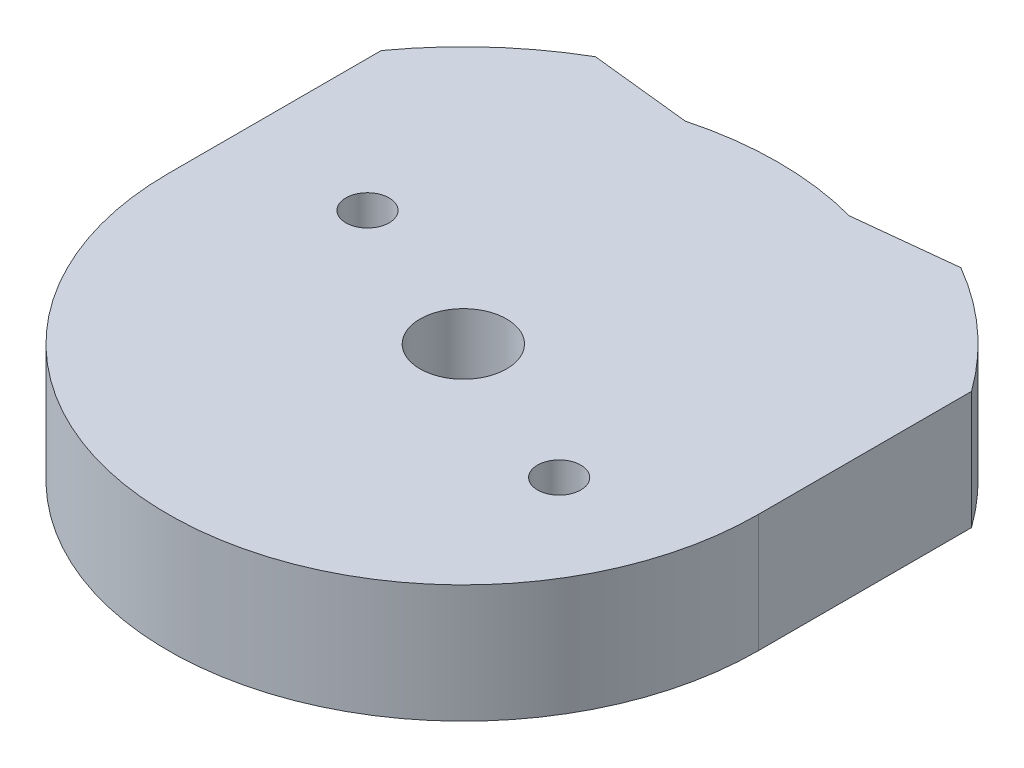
SolidWorks part; units mm, degrees
ref_plane "Face" through (0, 0, 0) normal (0, 0, 1) x (1, 0, 0)
ref_plane "Dessus" through (0, 0, 0) normal (0, 1, 0) x (1, 0, 0)
ref_plane "Droite" through (0, 0, 0) normal (1, 0, 0) x (0, 0, -1)
sketch "Esquisse1" plane through (0, 0, 0) normal (0, 1, 0) x (1, 0, 0)
  line L0 (51.9662, 0) -> (-18.6202, 0) construction
  line L1 (0, -18.98) -> (0, 28.1312) construction
  line L2 (15, -7.2752) -> (15, 19.8861) construction
  line L3 (-15, -14.6253) -> (-15, 19.8861) construction
  line L4 (-20.052, 16) -> (25.0707, 16) construction
  line L5 (-9, -4.0319) -> (-9, 1.7768) construction
  line L6 (15, 0) -> (15, 10.8282)
  line L7 (-15, 0) -> (-15, 10.8282)
  line L8 (-9.2871, 16) -> (-4.1648, 15.4484)
  line L9 (4.1648, 15.4484) -> (9.2871, 16)
  circle A0 centre (0, 0) radius 2.2
  arc A1 (-15, 0) -> (15, 0) centre (0, 0) ccw
  circle A2 centre (0, 0) radius 9 construction
  arc A3 (4.1648, 15.4484) -> (-4.1648, 15.4484) centre (0, 0) ccw
  arc A4 (-9.2871, 16) -> (-15, 10.8282) centre (0, 0) ccw
  arc A5 (15, 10.8282) -> (9.2871, 16) centre (0, 0) ccw
  circle A11 centre (8.3149, -3.4442) radius 1.1
  circle A19 centre (-8.3149, 3.4442) radius 1.1
  circle A22 centre (6.364, -6.364) radius 1.1
  circle A23 centre (-6.364, 6.364) radius 1.1
  circle A24 centre (-9, 0) radius 1.1
  circle A25 centre (9, 0) radius 1.1
  circle A26 centre (8.3149, 3.4442) radius 1.1
  circle A27 centre (6.364, 6.364) radius 1.1
  circle A28 centre (3.4442, 8.3149) radius 1.1
  circle A29 centre (0, 9) radius 1.1
  circle A30 centre (-3.4442, 8.3149) radius 1.1
  circle A31 centre (3.4442, -8.3149) radius 1.1
  circle A32 centre (0, -9) radius 1.1
  circle A33 centre (-3.4442, -8.3149) radius 1.1
  circle A34 centre (-6.364, -6.364) radius 1.1
  circle A35 centre (-8.3149, -3.4442) radius 1.1
  point P56 (-2.9499, 18.2633)
  dimension "D1" = 16
  dimension "D2" = 9
extrude "Extrusion1" add sketch "Esquisse1" along normal blind 6
